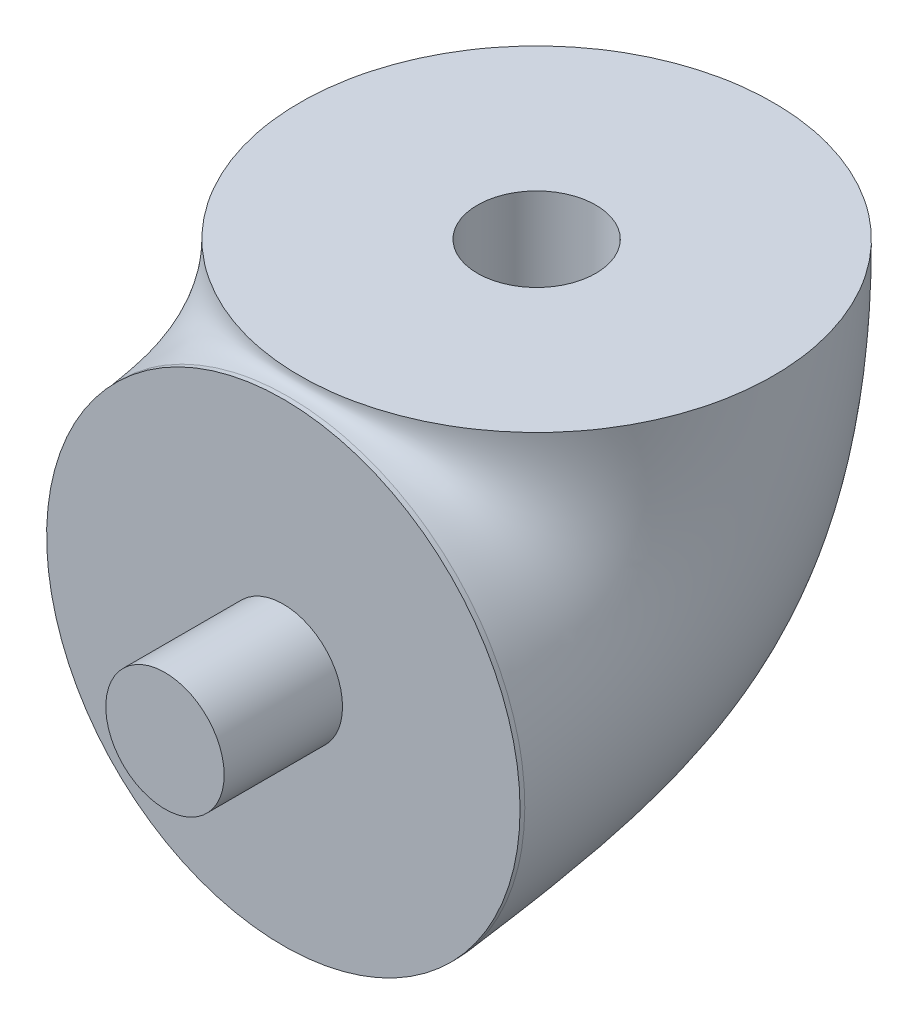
SolidWorks part; units mm, degrees
ref_plane "Ebene vorne" through (0, 0, 0) normal (0, 0, 1) x (1, 0, 0)
ref_plane "Ebene oben" through (0, 0, 0) normal (0, 1, 0) x (1, 0, 0)
ref_plane "Ebene rechts" through (0, 0, 0) normal (1, 0, 0) x (0, 0, -1)
sketch "Skizze1" plane through (0, 0, 0) normal (0, 0, 1) x (1, 0, 0)
  circle A0 centre (0, 0) radius 100
  dimension "D1" = 200
extrude "Aufsatz-Linear austragen1" add sketch "Skizze1" along normal blind 2
sketch "Skizze2" plane through (0, 0, 2) normal (0, 0, 1) x (1, 0, 0)
  circle A0 centre (0, 0) radius 25
  dimension "D1" = 50
extrude "Aufsatz-Linear austragen2" add sketch "Skizze2" along normal blind 50
ref_plane "Ebene1" through (0, 105, 0) normal (0, 1, 0) x (1, 0, 0)
sketch "Skizze4" plane through (0, 105, 0) normal (0, 1, 0) x (1, 0, 0)
  circle A0 centre (0, 105) radius 100
  dimension "D1" = 200
  dimension "D2" = 105
other "Begrenzung1"
sketch "Skizze5" plane through (0, 105, 0) normal (0, 1, 0) x (1, 0, 0)
  circle A1 centre (0, 105) radius 100 construction
  circle A2 centre (0, 105) radius 98
  circle A3 centre (0, 105) radius 98
  circle A4 centre (0, 105) radius 100
  dimension "D1" = 2
sketch "Skizze6" plane through (0, 105, 0) normal (0, 1, 0) x (1, 0, 0)
  circle A0 centre (0, 105) radius 25
  dimension "D1" = 50
extrude "Schnitt-Linear austragen1" cut sketch "Skizze6" against normal blind 50
